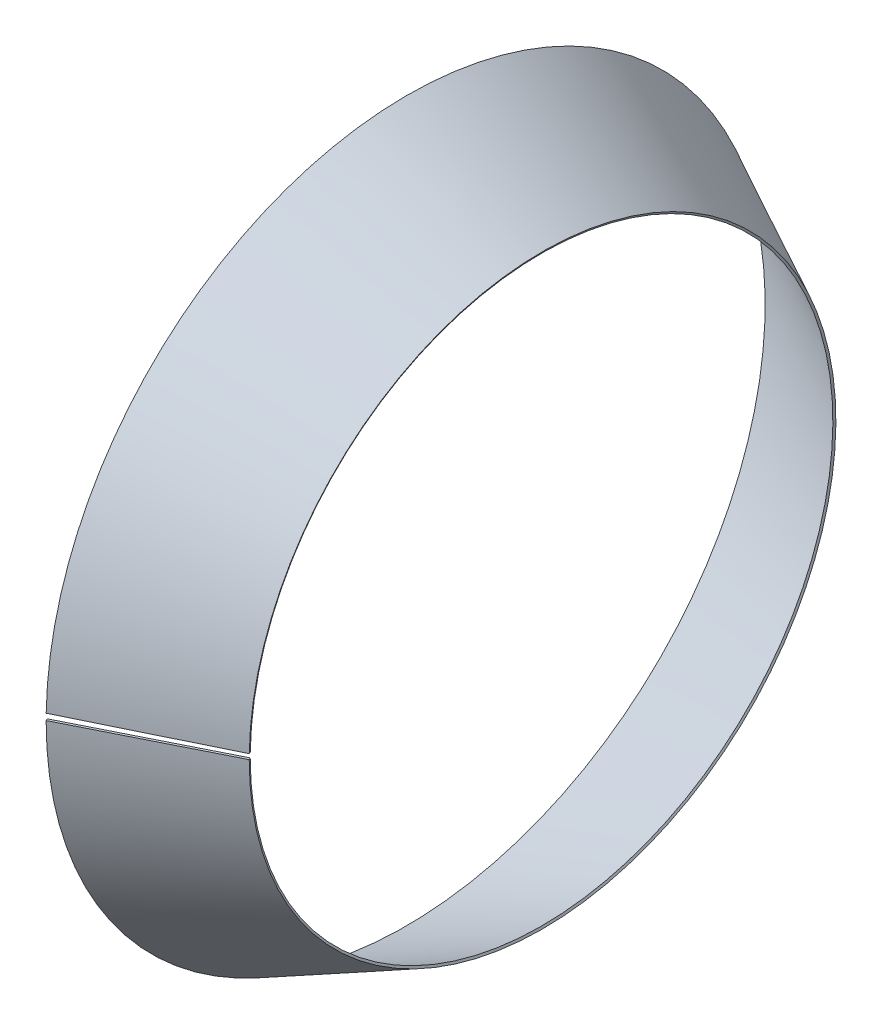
SolidWorks part; units mm, degrees
ref_plane "Vorne" through (0, 0, 0) normal (0, 0, 1) x (1, 0, 0)
ref_plane "Oben" through (0, 0, 0) normal (0, 1, 0) x (1, 0, 0)
ref_plane "Rechts" through (0, 0, 0) normal (1, 0, 0) x (0, 0, -1)
sketch "Skizze1" plane through (0, 0, 0) normal (1, 0, 0) x (0, -1, 0)
  line L0 (0, -160) -> (0, 0) construction
  line L1 (0, 0) -> (-2.7924, -159.9756) construction
  arc A0 (0, -160) -> (-2.7924, -159.9756) centre (0, 0) ccw
  dimension "D1" = 160
  dimension "D2" = 1
ref_plane "Ebene1" through (60, 0, 0) normal (1, 0, 0) x (0, 1, 0)
sketch "Skizze2" plane through (60, 0, 0) normal (1, 0, 0) x (0, 1, 0)
  arc A2 (0, 130) -> (2.2688, 129.9802) centre (0, 0) ccw
  arc A4 (0, 130) -> (2.2688, 129.9802) centre (0, 0) ccw
  dimension "D1" = 30
sheet metal parameters "Blech1" thickness 1 parameters "D1"=1, "Dicke"=1
lofted bend "Ausgeformte Biegungen1" parameters "D1"=0, "D12"=1
other "Freiform-Biegung1" parameters "D1"=1000, "D4"=359, "D5"=1
flat pattern "Abwicklung1"
sketch "Biegung-Linien1" plane through (-2.2339, 64, 127.9805) normal (-0.0156, 0.4472, 0.8943) x (0.9999, 0.007, 0.014)
  line L0 (-0.5585, -71.552) -> (-0.0349, -4.472) construction
  line L1 (-113.9449, 622.5353) -> (-92.1018, 559.1091) construction
other "Abwickeln-<Freiform-Biegung1>1"
